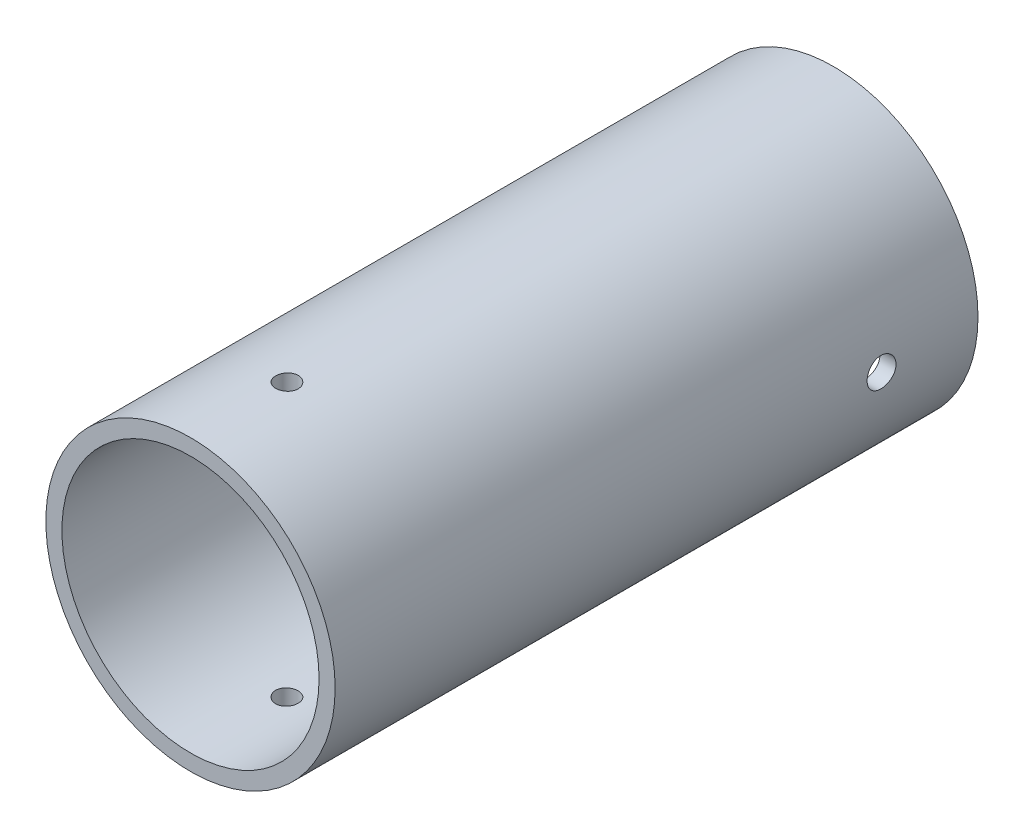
SolidWorks part; units mm, degrees
ref_plane "Front" through (0, 0, 0) normal (0, 0, 1) x (1, 0, 0)
ref_plane "Top" through (0, 0, 0) normal (0, 1, 0) x (1, 0, 0)
ref_plane "Right" through (0, 0, 0) normal (1, 0, 0) x (0, 0, -1)
sketch "Sketch1" plane through (0, 0, 0) normal (0, 0, 1) x (1, 0, 0)
  circle A0 centre (0, 0) radius 22.5
  circle A1 centre (0, 0) radius 20
extrude "Extrude1" add sketch "Sketch1" against normal blind 100
sketch "Sketch2" plane through (0, 0, 0) normal (1, 0, 0) x (0, 0, -1)
  circle A0 centre (85, 0) radius 2.25
extrude "Cut-Extrude1" cut sketch "Sketch2" along normal blind 100
sketch "Sketch3" plane through (0, 0, 0) normal (0, 1, 0) x (1, 0, 0)
  circle A0 centre (0, 15) radius 1.75
extrude "Cut-Extrude2" cut sketch "Sketch3" against normal mid plane 100
sketch "Sketch4" plane through (0, 0, 0) normal (1, 0, 0) x (0, 0, -1)
  circle A0 centre (52.591, 0) radius 0.001
extrude "Cut-Extrude3" cut sketch "Sketch4" against normal blind 30
